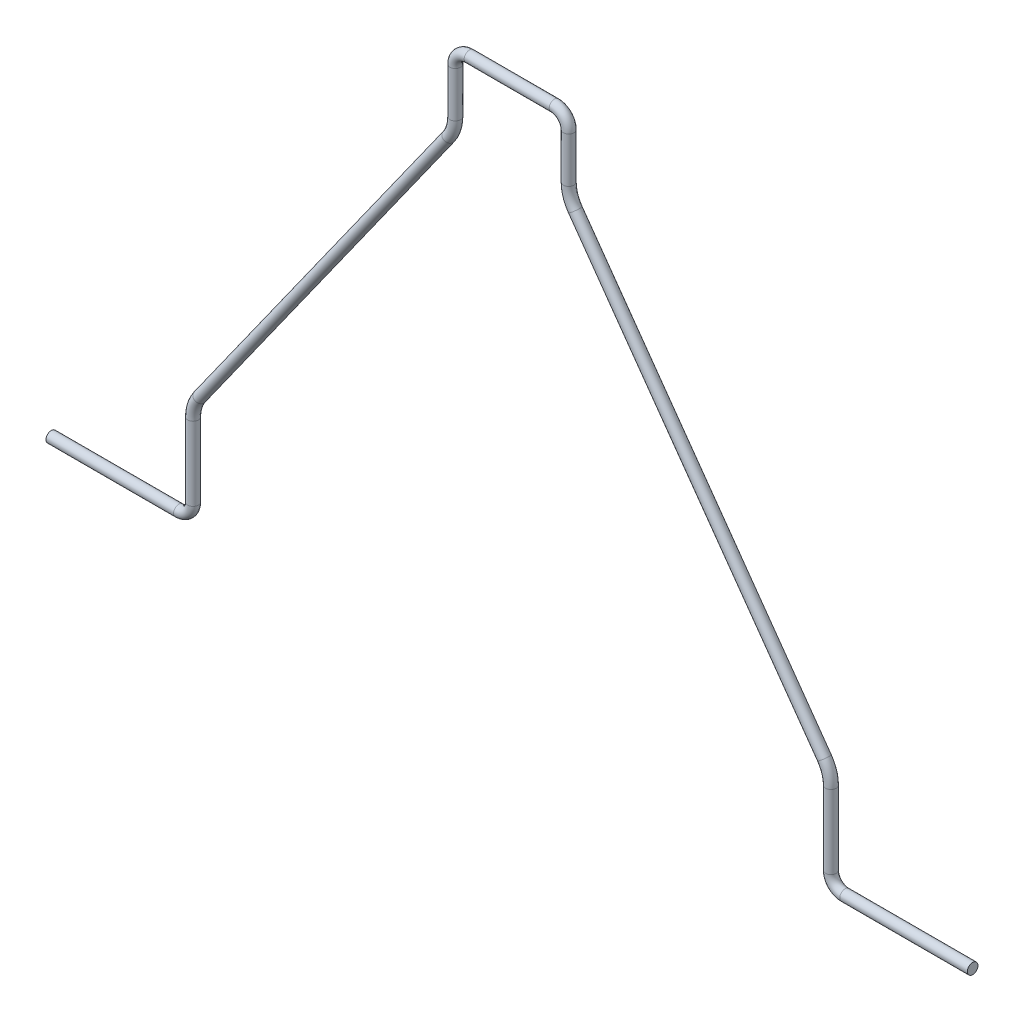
SolidWorks part; units mm, degrees
ref_plane "Plan de face" through (0, 0, 0) normal (0, 0, 1) x (1, 0, 0)
ref_plane "Plan de dessus" through (0, 0, 0) normal (0, 1, 0) x (1, 0, 0)
ref_plane "Plan de droite" through (0, 0, 0) normal (1, 0, 0) x (0, 0, -1)
sketch "Esquisse1" plane through (0, 0, 0) normal (1, 0, 0) x (0, 0, -1)
  circle A0 centre (0, 0) radius 0.75
ref_plane "Plan1" through (0, 0, 0) normal (0, 0, 1) x (1, 0, 0)
sketch "Esquisse2" plane through (0, 0, 0) normal (0, 0, 1) x (1, 0, 0)
  line L0 (-1.7093, 0) -> (34.3489, 0) construction
  line L1 (0, -3.2259) -> (0, 8.442) construction
  line L2 (20, -3.2259) -> (20, 22.036) construction
  line L3 (65, 81.8088) -> (65, -25.6343) construction
  line L4 (6.8436, 14) -> (36.7462, 14) construction
  line L5 (27.0537, 76) -> (121.2984, 76) construction
  line L6 (27.0537, 66) -> (104.3879, 66) construction
  line L7 (57, 81.8088) -> (57, 61.3925) construction
  line L8 (0, 0) -> (18, 0)
  line L9 (20, 2) -> (20, 12.4027)
  line L10 (20.926, 15.3015) -> (56.074, 64.6985)
  line L11 (57, 67.5973) -> (57, 74)
  line L12 (59, 76) -> (71, 76)
  line L13 (73, 67.5973) -> (73, 74)
  line L14 (109.074, 15.3015) -> (73.926, 64.6985)
  line L15 (110, 2) -> (110, 12.4027)
  line L16 (130, 0) -> (112, 0)
  arc A0 (73, 74) -> (71, 76) centre (71, 74) ccw
  arc A1 (57, 74) -> (59, 76) centre (59, 74) cw
  arc A2 (110, 2) -> (112, 0) centre (112, 2) ccw
  arc A3 (18, 0) -> (20, 2) centre (18, 2) ccw
  arc A4 (56.074, 64.6985) -> (57, 67.5973) centre (52, 67.5973) ccw
  arc A5 (73, 67.5973) -> (73.926, 64.6985) centre (78, 67.5973) ccw
  arc A6 (109.074, 15.3015) -> (110, 12.4027) centre (105, 12.4027) cw
  arc A7 (20, 12.4027) -> (20.926, 15.3015) centre (25, 12.4027) cw
  point P24 (65, 76)
  point P30 (73, 76)
  point P33 (57, 76)
  point P36 (110, 0)
  point P39 (20, 0)
  point P42 (57, 66)
  point P45 (73, 66)
  point P48 (110, 14)
  point P51 (20, 14)
  dimension "D7" = 2
  dimension "D8" = 5
  dimension "D1" = 20
  dimension "D2" = 14
  dimension "D3" = 45
  dimension "D4" = 10
  dimension "D5" = 62
  dimension "D6" = 8
sweep "Balayage2" add profiles "Esquisse1" path "Esquisse2"
